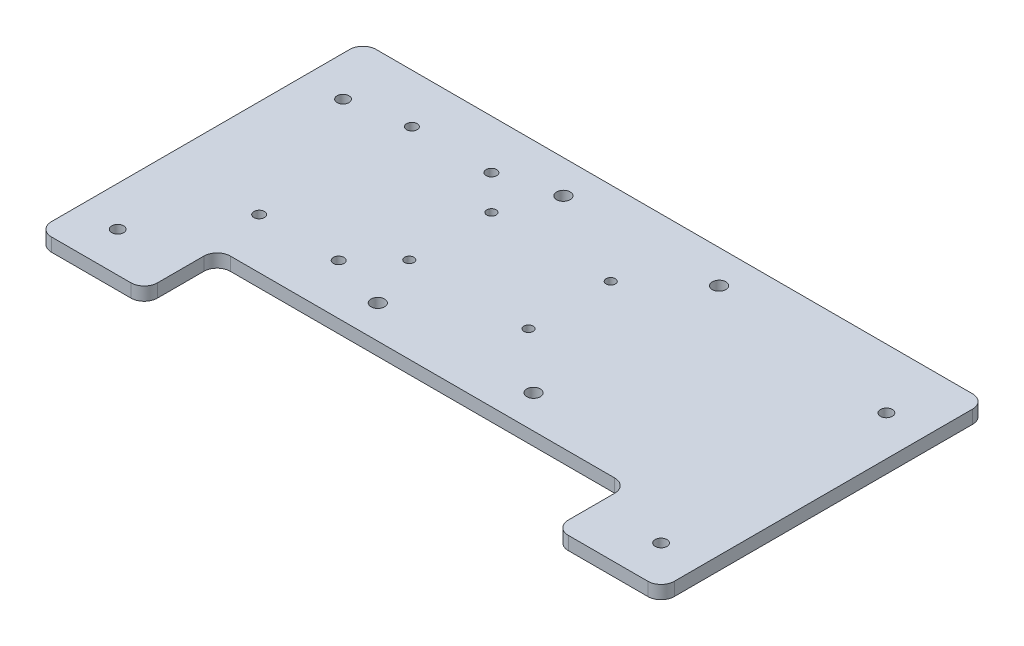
SolidWorks part; units mm, degrees
ref_plane "Face" through (0, 0, 0) normal (0, 0, 1) x (1, 0, 0)
ref_plane "Dessus" through (0, 0, 0) normal (0, 1, 0) x (1, 0, 0)
ref_plane "Droite" through (0, 0, 0) normal (1, 0, 0) x (0, 0, -1)
sketch "Esquisse1" plane through (0, 0, 0) normal (0, 1, 0) x (1, 0, 0)
  line L0 (0, 0) -> (0, 245) construction
  line L1 (165, 0) -> (225, 0)
  line L2 (-145, 55) -> (145, 55)
  line L3 (-225, 245) -> (225, 245)
  line L4 (235, 10) -> (235, 235)
  line L5 (155, 45) -> (155, 10)
  line L6 (-155, 45) -> (-155, 10)
  line L7 (-235, 10) -> (-235, 235)
  line L8 (-165, 0) -> (-225, 0)
  arc A0 (155, 45) -> (145, 55) centre (145, 45) ccw
  arc A1 (165, 0) -> (155, 10) centre (165, 10) cw
  arc A2 (235, 10) -> (225, 0) centre (225, 10) cw
  arc A3 (225, 245) -> (235, 235) centre (225, 235) cw
  circle A4 centre (205, 200) radius 4.5
  circle A5 centre (205, 30) radius 4.5
  circle A6 centre (-205, 30) radius 4.5
  circle A7 centre (-205, 200) radius 4.5
  arc A8 (-225, 245) -> (-235, 235) centre (-225, 235) ccw
  arc A9 (-235, 10) -> (-225, 0) centre (-225, 10) ccw
  arc A10 (-165, 0) -> (-155, 10) centre (-165, 10) ccw
  arc A11 (-155, 45) -> (-145, 55) centre (-145, 45) cw
  circle A12 centre (-75, 182) radius 3.5
  circle A13 centre (-75, 120) radius 3.5
  circle A14 centre (15, 182) radius 3.5
  circle A15 centre (15, 120) radius 3.5
  point P14 (235, 0)
  point P17 (235, 245)
  point P38 (0, 55)
  dimension "D5" = 10
  dimension "D6" = 30
  dimension "D7" = 170
  dimension "D9" = 9
  dimension "D10" = 9
  dimension "D11" = 7
  dimension "D12" = 7
  dimension "D13" = 7
  dimension "D14" = 7
  dimension "D17" = 90
  dimension "D1" = 235
  dimension "D2" = 245
  dimension "D3" = 190
  dimension "D4" = 80
  dimension "D8" = 205
  dimension "D15" = 65
  dimension "D16" = 62
  dimension "D18" = 160
extrude "Base-Extrusion" add sketch "Esquisse1" along normal blind 10
sketch "Esquisse2" plane through (0, 10, 0) normal (0, 1, 0) x (-1, 0, 0)
  line L0 (145, -55) -> (-145, -55) construction
  line L1 (-225, -245) -> (225, -245) construction
  circle A0 centre (58.75, -80) radius 5.125
  circle A1 centre (-58.75, -80) radius 5.125
  circle A2 centre (58.75, -220) radius 5.125
  circle A3 centre (-58.75, -220) radius 5.125
  dimension "D2" = 58.75
  dimension "D3" = 10.25
  dimension "D4" = 10.25
  dimension "D5" = 10.25
  dimension "D6" = 10.25
  dimension "D8" = 25
  dimension "D1" = 58.75
  dimension "D7" = 25
extrude "Enlèv. mat.-Extru.1" cut sketch "Esquisse2" against normal through all
sketch "Esquisse3" plane through (0, 10, 0) normal (0, 1, 0) x (-1, 0, 0)
  line L0 (58.75, -220) -> (58.75, -80) construction
  line L1 (-225, -245) -> (225, -245) construction
  circle A0 centre (101.05, -208) radius 4
  circle A1 centre (101.2784, -93.0002) radius 4
  circle A2 centre (161.2784, -93.0002) radius 4
  circle A3 centre (161.05, -208) radius 4
  dimension "D1" = 60
  dimension "D2" = 115
  dimension "D3" = 60
  dimension "D4" = 115
  dimension "D5" = 42.3
  dimension "D6" = 37
  dimension "D7" = 37
extrude "Enlèv. mat.-Extru.2" cut sketch "Esquisse3" against normal up to next
